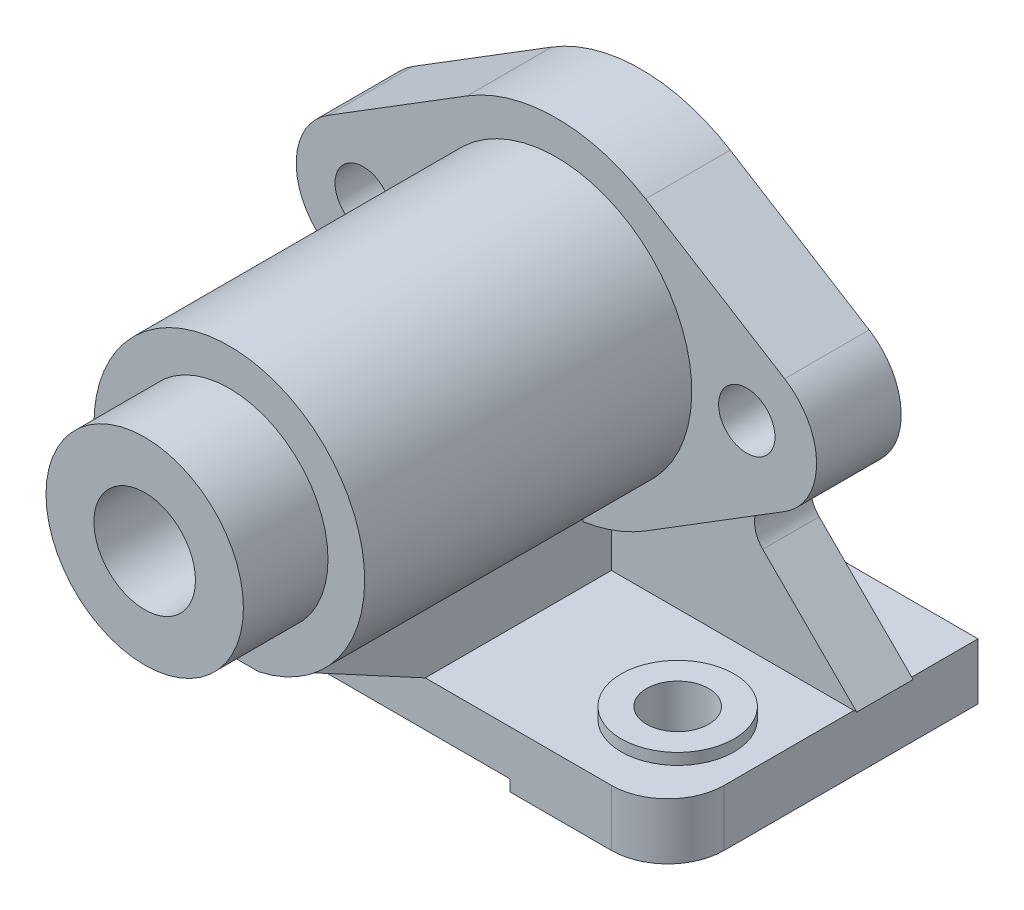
SolidWorks part; units mm, degrees
ref_plane "前视" through (0, 0, 0) normal (0, 0, 1) x (1, 0, 0)
ref_plane "上视" through (0, 0, 0) normal (0, 1, 0) x (1, 0, 0)
ref_plane "右视" through (0, 0, 0) normal (1, 0, 0) x (0, 0, -1)
sketch "草图1" plane through (0, 0, 0) normal (0, 0, 1) x (1, 0, 0)
  line L0 (-100.076, -48.514) -> (-72.076, -48.514)
  line L1 (-4.076, -48.514) -> (-4.076, -38.514)
  line L2 (-4.076, -38.514) -> (-100.076, -38.514)
  line L3 (-100.076, -38.514) -> (-100.076, -48.514)
  line L4 (-32.076, -48.514) -> (-4.076, -48.514)
  line L5 (-72.076, -46.514) -> (-72.076, -48.514)
  line L8 (-32.076, -46.514) -> (-32.076, -48.514)
  line L12 (-72.076, -46.514) -> (-32.076, -46.514)
  dimension "D1" = 96
  dimension "D2" = 10
extrude "拉伸1" add sketch "草图1" along normal blind 55
sketch "草图2" plane through (0, -38.514, 0) normal (0, 1, 0) x (-1, 0, 0)
  circle A0 centre (18.3305, 39) radius 10
  circle A1 centre (86.3305, 39) radius 10
  dimension "D1" = 20
  dimension "D2" = 20
extrude "拉伸2" add sketch "草图2" along normal blind 2
sketch "草图3" plane through (0, -36.514, 0) normal (0, 1, 0) x (-1, 0, 0)
  circle A0 centre (18.3305, 39) radius 5.5
  circle A1 centre (86.3305, 39) radius 5.5
  circle A2 centre (18.3305, 39) radius 10 construction
  circle A3 centre (86.3305, 39) radius 10 construction
  dimension "D1" = 11
  dimension "D2" = 11
extrude "切除-拉伸1" cut sketch "草图3" against normal through all
sketch "草图4" plane through (0, 0, 0) normal (0, 0, -1) x (-1, 0, 0)
  line L0 (3.5772, -38.514) -> (100.076, -38.514)
  line L1 (92.2868, 11.2741) -> (67.6476, 26.5675)
  line L2 (3.5772, -38.514) -> (20.2402, -21.851)
  line L3 (11.3664, -9.1172) -> (19.3415, -14.0673)
  line L4 (92.2868, -9.1172) -> (84.3117, -14.0673)
  line L5 (51.8266, 36.1503) -> (51.8266, 31.0784) construction
  line L6 (-0.7639, 1.0784) -> (5.6948, 1.0784) construction
  line L7 (11.3664, 11.2741) -> (36.0056, 26.5675)
  line L8 (100.076, -38.514) -> (83.413, -21.851)
  line L9 (97.9584, 1.0784) -> (105.8811, 1.0784) construction
  arc A0 (19.3415, -14.0673) -> (20.2402, -21.851) centre (16.7047, -18.3155) cw
  arc A1 (92.2868, -9.1172) -> (92.2868, 11.2741) centre (85.9584, 1.0784) ccw
  arc A2 (67.6476, 26.5675) -> (36.0056, 26.5675) centre (51.8266, 1.0784) ccw
  arc A3 (11.3664, -9.1172) -> (11.3664, 11.2741) centre (17.6948, 1.0784) cw
  arc A4 (84.3117, -14.0673) -> (83.413, -21.851) centre (86.9485, -18.3155) ccw
extrude "拉伸3" add sketch "草图4" against normal blind 22
sketch "草图18" plane through (0, 0, 0) normal (1, 0, 0) x (0, 0, -1)
  line L0 (1.4238, 32.8031) -> (1.4238, 31.0784)
  line L3 (1.4238, -38.514) -> (-12, -38.514)
  line L5 (-22, -38.514) -> (0, -38.514) construction
  line L6 (1.4238, -38.514) -> (1.4238, 31.0784)
  line L11 (-12, -38.514) -> (-12, 30.897)
  line L13 (-12, 30.897) -> (-12, 32.8031)
  line L14 (-12, 32.8031) -> (1.4238, 32.8031)
extrude "切除-拉伸8" cut sketch "草图18" against normal blind 115
sketch "草图19" plane through (0, 0, 22) normal (0, 0, 1) x (1, 0, 0)
  line L0 (-102.8073, 1.0784) -> (-1.4701, 1.0784) construction
  line L1 (-92.2868, 11.2741) -> (-67.6476, 26.5675)
  line L2 (-11.3664, 11.2741) -> (-36.0056, 26.5675)
  line L3 (-11.3664, -9.1172) -> (-36.0056, -24.4107)
  line L4 (-92.2868, -9.1172) -> (-67.6476, -24.4107)
  arc A0 (-92.2868, 11.2741) -> (-92.2868, -9.1172) centre (-85.9584, 1.0784) ccw
  arc A1 (-36.0056, 26.5675) -> (-67.6476, 26.5675) centre (-51.8266, 1.0784) ccw
  arc A2 (-11.3664, -9.1172) -> (-11.3664, 11.2741) centre (-17.6948, 1.0784) ccw
  arc A3 (-92.2868, 11.2741) -> (-92.2868, -9.1172) centre (-85.9584, 1.0784) ccw construction
  arc A4 (-36.0056, 26.5675) -> (-67.6476, 26.5675) centre (-51.8266, 1.0784) ccw construction
  arc A5 (-11.3664, -9.1172) -> (-11.3664, 11.2741) centre (-17.6948, 1.0784) ccw construction
  arc A6 (-36.0056, -24.4107) -> (-67.6476, -24.4107) centre (-51.8266, 1.0784) cw
extrude "拉伸4" add sketch "草图19" along normal blind 5
sketch "草图20" plane through (0, 0, 12) normal (0, 0, -1) x (-1, 0, 0)
  circle A0 centre (51.8266, 1.0784) radius 24
  arc A1 (67.6476, 26.5675) -> (36.0056, 26.5675) centre (51.8266, 1.0784) ccw construction
  dimension "D1" = 48
extrude "拉伸5" add sketch "草图20" along normal blind 2
sketch "草图21" plane through (0, 0, 27) normal (0, 0, 1) x (1, 0, 0)
  circle A0 centre (-51.8266, 1.0784) radius 24
  arc A1 (-36.0056, 26.5675) -> (-67.6476, 26.5675) centre (-51.8266, 1.0784) ccw construction
  dimension "D1" = 48
extrude "拉伸6" add sketch "草图21" along normal blind 58
sketch "草图22" plane through (0, 0, 85) normal (0, 0, 1) x (1, 0, 0)
  circle A0 centre (-51.8266, 1.0784) radius 17.5
  circle A1 centre (-51.8266, 1.0784) radius 24 construction
  dimension "D1" = 35
extrude "拉伸7" add sketch "草图22" along normal blind 15
sketch "草图23" plane through (0, 0, 85) normal (0, 0, 1) x (1, 0, 0)
  line L0 (-57.076, -22.3404) -> (-57.076, -38.514)
  line L2 (-4.076, -38.514) -> (-100.076, -38.514) construction
  line L3 (-57.076, -38.514) -> (-47.076, -38.514)
  line L5 (-47.076, -38.514) -> (-47.076, -22.4467)
  arc A0 (-57.076, -22.3404) -> (-47.076, -22.4467) centre (-51.8266, 1.0784) ccw
  circle A1 centre (-51.8266, 1.0784) radius 24 construction
extrude "拉伸9" add sketch "草图23" against normal up to surface (85 mm away)
sketch "草图24" plane through (-57.076, 0, 0) normal (-1, 0, 0) x (0, 0, 1)
  line L0 (85, -22.3404) -> (55, -38.514)
  line L1 (55, -38.514) -> (85, -38.514)
  line L2 (85, -38.514) -> (85, -22.3404)
extrude "切除-拉伸9" cut sketch "草图24" against normal blind 63
sketch "草图25" plane through (-57.076, 0, 0) normal (-1, 0, 0) x (0, 0, 1)
  line L0 (10, -22.3404) -> (0, -38.514)
  line L1 (0, -38.514) -> (0, -22.3404)
  line L2 (0, -22.3404) -> (10, -22.3404)
extrude "切除-拉伸10" cut sketch "草图25" against normal blind 63
sketch "草图26" plane through (0, 0, 10) normal (0, 0, -1) x (-1, 0, 0)
  circle A0 centre (51.8266, 1.0784) radius 21
  arc A1 (57.076, -22.3404) -> (47.076, -22.4467) centre (51.8266, 1.0784) ccw construction
  dimension "D1" = 42
extrude "切除-拉伸11" cut sketch "草图26" against normal blind 12
sketch "草图27" plane through (0, 0, 22) normal (0, 0, -1) x (-1, 0, 0)
  circle A0 centre (51.8266, 1.0784) radius 18
  circle A1 centre (51.8266, 1.0784) radius 21 construction
  dimension "D1" = 36
extrude "切除-拉伸12" cut sketch "草图27" against normal blind 56
sketch "草图29" plane through (0, 0, 100) normal (0, 0, 1) x (1, 0, 0)
  circle A0 centre (-51.8266, 1.0784) radius 9
  circle A1 centre (-51.8266, 1.0784) radius 17.5 construction
  dimension "D1" = 18
extrude "切除-拉伸13" cut sketch "草图29" against normal blind 56
chamfer "倒角1" distance 1 angle 45
sketch "草图30" plane through (0, -38.514, 0) normal (0, 1, 0) x (-1, 0, 0)
  line L0 (100.076, 55) -> (90.076, 55)
  line L1 (57.076, 55) -> (100.076, 55) construction
  line L2 (100.076, 55) -> (100.076, 45)
  line L3 (100.076, 55) -> (100.076, 22) construction
  line L4 (4.076, 55) -> (14.076, 55)
  line L5 (4.076, 55) -> (47.076, 55) construction
  line L6 (4.076, 55) -> (4.076, 45)
  line L7 (4.076, 55) -> (4.076, 22) construction
  arc A0 (100.076, 45) -> (90.076, 55) centre (90.076, 45) ccw
  arc A1 (14.076, 55) -> (4.076, 45) centre (14.076, 45) ccw
  dimension "D1" = 10
  dimension "D2" = 10
  dimension "D3" = 10
extrude "切除-拉伸14" cut sketch "草图30" against normal blind 56
sketch "草图31" plane through (0, 0, 12) normal (0, 0, -1) x (-1, 0, 0)
  line L0 (52.076, -38.514) -> (52.076, 33.6275) construction
  line L2 (47.076, -38.514) -> (57.076, -38.514) construction
  circle A0 centre (86.076, 1.486) radius 5
  circle A1 centre (18.076, 1.486) radius 5
  dimension "D2" = 10
extrude "切除-拉伸15" cut sketch "草图31" against normal blind 30
